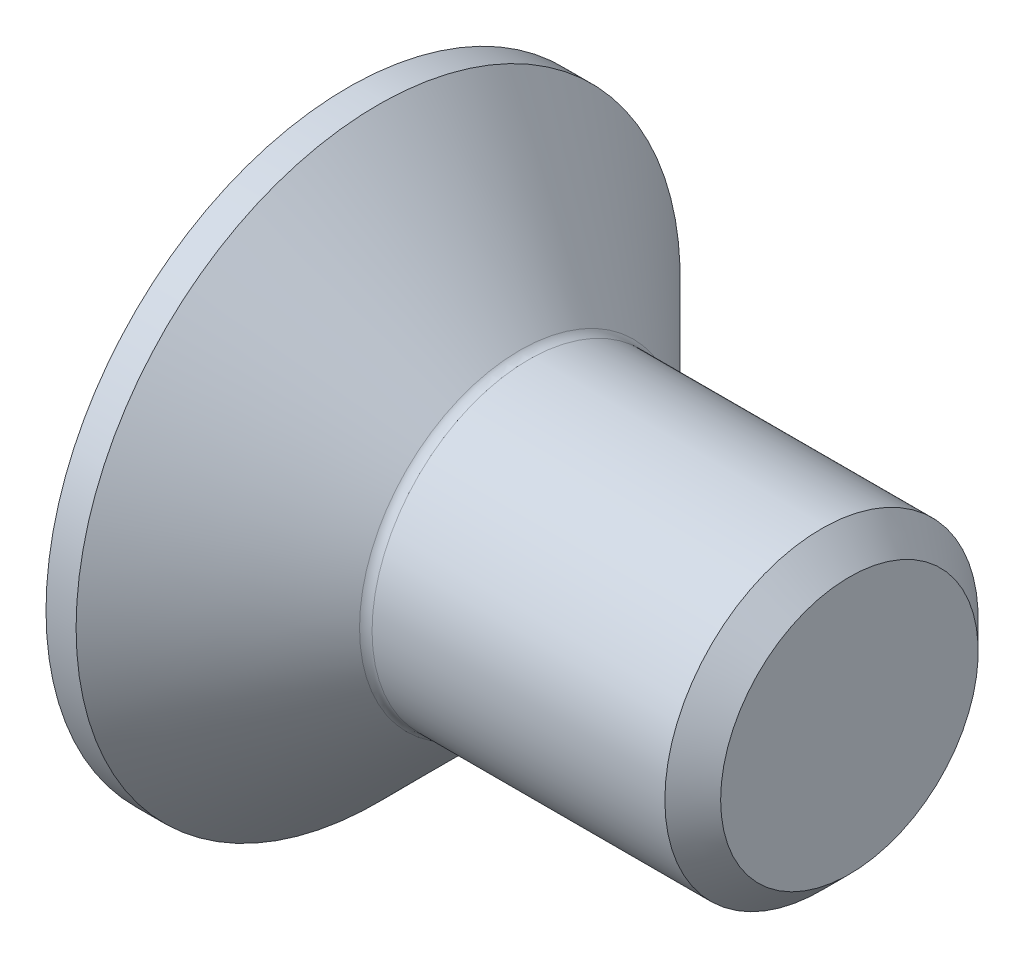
SolidWorks part; units mm, degrees
revolve "PreBroach" cut sketch "Sketch2"
sketch "Sketch2"
  line L0 (0, 1.51) -> (2.3, 1.51)
  line L1 (2.3, 1.51) -> (3.1718, 0)
  line L2 (0, 0) -> (127, 0) construction
  line L3 (3.1718, 0) -> (0, 0)
  line L4 (0, 0) -> (0, 1.51)
  line L5 (0, -1.51) -> (2.3, -1.51) construction
  line L6 (0, 0) -> (47.625, 0) construction
  line L8 (0, 4.82) -> (0, -4.82) construction
revolve "BaseBody" add sketch "BodySke" angle 360 about L6
sketch "BodySke" plane through (0, 0, 0) normal (0, 0, 1) x (1, 0, 0)
  line L0 (0, 0) -> (0, 4.82)
  line L1 (0.48, 4.82) -> (2.8, 2.5)
  line L2 (0, 4.82) -> (0.48, 4.82)
  line L3 (2.8, 2.5) -> (7.555, 2.5)
  line L4 (8, 2.055) -> (8, 0)
  line L5 (8, 0) -> (0, 0)
  line L6 (0, 0) -> (127, 0) construction
  line L7 (0.48, -4.82) -> (2.8, -2.5) construction
  line L8 (8, 2.055) -> (7.555, 2.5)
  line L9 (0, -4.82) -> (0.48, -4.82) construction
  line L10 (8, -2.055) -> (7.555, -2.5) construction
  line L11 (3.6, 8.85) -> (3.6, -13.375) construction
  line L12 (3.2, 16.35) -> (3.2, -5.875) construction
ref_plane "Plane1" through (0, 0, 0) normal (0, 0, 1) x (1, 0, 0)
ref_plane "Plane2" through (0, 0, 0) normal (0, 1, 0) x (1, 0, 0)
ref_plane "Plane3" through (0, 0, 0) normal (1, 0, 0) x (0, 0, -1)
fillet "Fillet1" radius 0.2 1 edges at (2.8, 0, 2.5)
sketch "Sketch3" plane through (0, 0, 0) normal (-1, 0, 0) x (0, 0, 1)
  line L0 (-1.51, -0.8718) -> (-1.51, 0.8718)
  line L1 (-1.51, 0.8718) -> (0, 1.7436)
  line L2 (0, 1.7436) -> (1.51, 0.8718)
  line L3 (1.51, 0.8718) -> (1.51, -0.8718)
  line L4 (1.51, -0.8718) -> (0, -1.7436)
  line L5 (0, -1.7436) -> (-1.51, -0.8718)
extrude "Hex" cut sketch "Sketch3" against normal blind 2.3
sketch "ThdSchSke" plane through (0, 0, 0) normal (0, 0, 1) x (1, 0, 0)
  line L0 (4, -2.055) -> (3.6884, -2.5)
  line L1 (4, -2.055) -> (4.3116, -2.5)
  line L2 (4.3116, -2.5) -> (4.3116, -3.125)
  line L3 (-3.175, 0) -> (5.1513, 0) construction
  line L4 (0, 4.82) -> (0, -4.82) construction
  line L5 (4.3116, -3.125) -> (3.6884, -3.125)
  line L6 (3.6884, -3.125) -> (3.6884, -2.5)
revolve "ThreadSchematic" [suppressed] cut sketch "ThdSchSke" angle 360 about L3
pattern_linear "ThdSchPat" [suppressed]
thread "Filetage1" pitch 0.8 start angle 0, offset 5, length 9, pitch 0.8, diameter 5
ref_plane "Plan2" through (12.555, 0, 2.5) normal (0, -1, 0) x (0, 0, 1)
sketch "Profil de filetage2" plane through (12.555, 0, 2.5) normal (0, -1, 0) x (0, 0, 1)
  line L0 (0, 0) -> (0, 0.8) construction
  line L11 (0, 0) -> (0, 0.7)
  line L12 (0, 0.7) -> (-0.433, 0.45)
  line L13 (-0.433, 0.45) -> (-0.433, 0.25)
  line L15 (-0.433, 0.25) -> (0, 0)
  line L17 (-0.433, 0.35) -> (0, 0.35) construction
  point P2 (0, 0)
  dimension "Pitch" = 0.8
  dimension "Profile_Angle" = 60
  dimension "Profile_Land" = 0.2
  dimension "Profile_Height" = 0.433
equation "\"Thread_minor@ThreadCosmetic\"  =  \"Minor_dia@BodySke\""
equation "\"D1@Sketch3\" = \"Hex_size@Sketch3\" / 2"
equation "\"D2@Sketch3\" = \"D1@Sketch3\""
equation "\"D3@Sketch3\" = \"Hex_size@Sketch3\""
equation "\"Thread_minor@ThdSchSke\" = \"Minor_dia@BodySke\""
equation "\"Diameter@ThdSchSke\" = \"Diameter@BodySke\""
equation "\"Overcut@ThdSchSke\" = \"Diameter@BodySke\" * 1.25"
